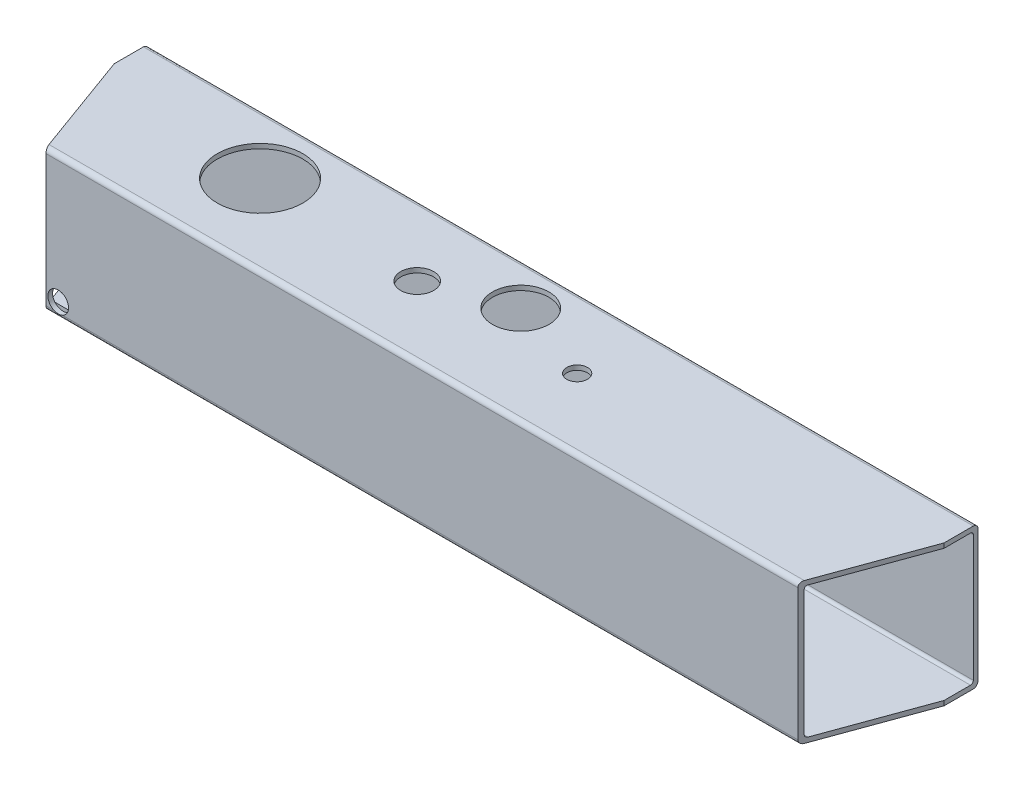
SolidWorks part; units mm, degrees
ref_plane "Plan de face" through (0, 0, 0) normal (0, 0, 1) x (1, 0, 0)
ref_plane "Plan de dessus" through (0, 0, 0) normal (0, 1, 0) x (1, 0, 0)
ref_plane "Plan de droite" through (0, 0, 0) normal (1, 0, 0) x (0, 0, -1)
sketch "Esquisse1" plane through (0, 0, 0) normal (0, 0, 1) x (1, 0, 0)
  line L0 (-441, 0) -> (441, 0)
  dimension "D1" = 882
other "Elément mécano-soudé1"
ref_plane "Plan1" through (-441, 0, 0) normal (1, 0, 0) x (0, 0, -1)
sketch "Esquisse11" plane through (-441, 0, 75) normal (1, 0, 0) x (0, 0, -1)
  line L0 (0, 75) -> (0, -75) construction
  line L1 (-70, 75) -> (70, 75)
  line L2 (-75, 70) -> (-75, -70)
  line L3 (-70, -75) -> (70, -75)
  line L4 (75, 70) -> (75, -70)
  line L5 (-75, 0) -> (75, 0) construction
  line L6 (-70, 67) -> (-70, -67)
  line L7 (-67, -70) -> (67, -70)
  line L8 (70, -67) -> (70, 67)
  line L9 (67, 70) -> (-67, 70)
  arc A0 (-70, 75) -> (-75, 70) centre (-70, 70) ccw
  arc A1 (75, 70) -> (70, 75) centre (70, 70) ccw
  arc A2 (70, -75) -> (75, -70) centre (70, -70) ccw
  arc A3 (-75, -70) -> (-70, -75) centre (-70, -70) ccw
  arc A4 (-67, 70) -> (-70, 67) centre (-67, 67) ccw
  arc A5 (70, 67) -> (67, 70) centre (67, 67) ccw
  arc A6 (67, -70) -> (70, -67) centre (67, -67) ccw
  arc A7 (-70, -67) -> (-67, -70) centre (-67, -67) ccw
  point P29 (0, 0)
  dimension "D1" = 5
  dimension "D3" = 3
  dimension "D2" = 150
  dimension "D4" = 5
  dimension "D5" = 5
  dimension "D6" = 5
  dimension "D7" = 5
sketch "Esquisse12" plane through (0, 75, 0) normal (0, 1, 0) x (-1, 0, 0)
  line L0 (441, 36) -> (399.5074, 150)
  line L1 (441, 5) -> (441, 145) construction
  line L2 (-441, 150) -> (441, 150) construction
  line L3 (399.5074, 150) -> (441, 150)
  line L4 (441, 150) -> (441, 36)
  dimension "D1" = 114
  dimension "D2" = 20
extrude "Enlèv. mat.-Extru.1" cut sketch "Esquisse12" against normal through all
mirror "Symétrie1" about plane through (0, 0, 0) normal (1, 0, 0) of "Enlèv. mat.-Extru.1"
hole_wizard "Diamètre du perçage Ø22.0 (22)1" positions "Esquisse3D1" profile "Esquisse13" hole size "Ø22.0" standard "ISO"
sketch3d "Esquisse3D1"
  line L0 (441, 75, 5) -> (441, 75, 36) construction
  line L1 (-399.5074, -70, 150) -> (-399.5074, 70, 150) construction
  point P0 (90, 75, 75)
  point P2 (-386.5074, -60, 150)
  dimension "D1" = 351
  dimension "D2" = 75
  dimension "D3" = 15
  dimension "D4" = 13
sketch "Esquisse13" plane through (90, 75, 75) normal (1, 0, 0) x (0, 0, 1)
  line L0 (0, 0) -> (0, 5)
  line L1 (0, 5) -> (11, 5)
  line L2 (11, 5) -> (11, 0)
  line L5 (11, 0) -> (0, 0)
  line L11 (0, -6.35) -> (0, 107.95) construction
  dimension "Diamètre du perçage jusqu'au prochain" = 22
  dimension "Profondeur du perçage jusqu'au prochain" = 5
sketch "Esquisse14" plane through (0, 75, 0) normal (0, 1, 0) x (-1, 0, 0)
  line L0 (441, 0) -> (-441, 0) construction
  line L1 (-441, 5) -> (-441, 36) construction
  line L2 (441, 5) -> (441, 36) construction
  line L3 (-399.5074, 150) -> (399.5074, 150) construction
  circle A0 centre (0, 45) radius 30
  circle A1 centre (80, 75) radius 17.5
  circle A2 centre (258, 64) radius 45.5
  dimension "D1" = 91
  dimension "D2" = 35
  dimension "D3" = 60
  dimension "D8" = 183
  dimension "D9" = 86
  dimension "D4" = 75
  dimension "D5" = 45
  dimension "D6" = 441
  dimension "D7" = 521
extrude "Enlèv. mat.-Extru.2" cut sketch "Esquisse14" against normal up to next
sketch "Esquisse15" plane through (0, -75, 0) normal (0, -1, 0) x (1, 0, 0)
  circle A0 centre (0, 45) radius 40
  dimension "D1" = 80
extrude "Enlèv. mat.-Extru.4" cut sketch "Esquisse15" against normal up to next
